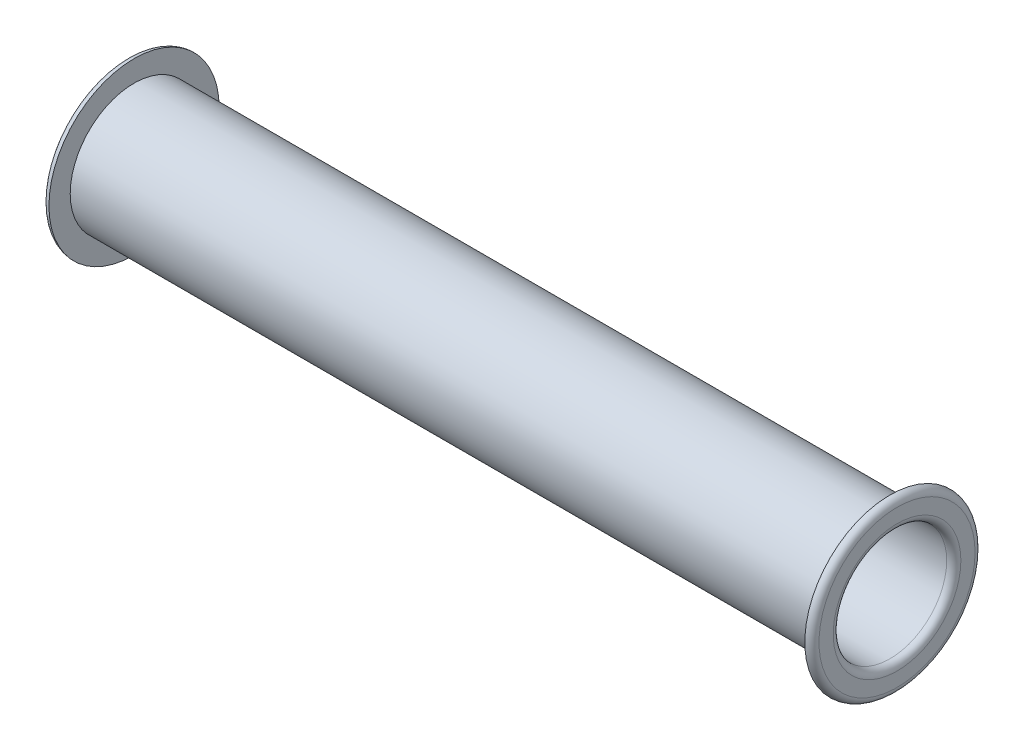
SolidWorks part; units mm, degrees
ref_plane "Front" through (0, 0, 0) normal (0, 0, 1) x (1, 0, 0)
ref_plane "Top" through (0, 0, 0) normal (0, 1, 0) x (1, 0, 0)
ref_plane "Right" through (0, 0, 0) normal (1, 0, 0) x (0, 0, -1)
sketch "Sketch1" plane through (0, 0, 0) normal (1, 0, 0) x (0, 0, -1)
  circle A0 centre (0, 0) radius 2.286
  dimension "D1" = 4.572
extrude "Extrude1" add sketch "Sketch1" along normal mid plane 27.0637
sketch "Sketch2" plane through (13.5318, 0, 0) normal (1, 0, 0) x (0, 0, -1)
  circle A2 centre (0, 0) radius 3.048
  circle A3 centre (0, 0) radius 3.048
  dimension "D1" = 0.762
extrude "Extrude2" add sketch "Sketch2" along normal blind 0.254
fillet "Fillet1" radius 0.254 1 edges at (13.7858, 0, -3.048)
mirror "Mirror1" about plane through (0, 0, 0) normal (1, 0, 0) of "Extrude2", "Fillet1"
sketch "Sketch3" plane through (13.7858, 0, 0) normal (1, 0, 0) x (0, 0, -1)
  circle A0 centre (0, 0) radius 2.032
  dimension "D1" = 4.064
extrude "Cut-Extrude1" cut sketch "Sketch3" against normal through all
fillet "Fillet2" radius 0.254 2 edges at (-13.7858, 0, -2.032) (13.7858, 0, -2.032)
